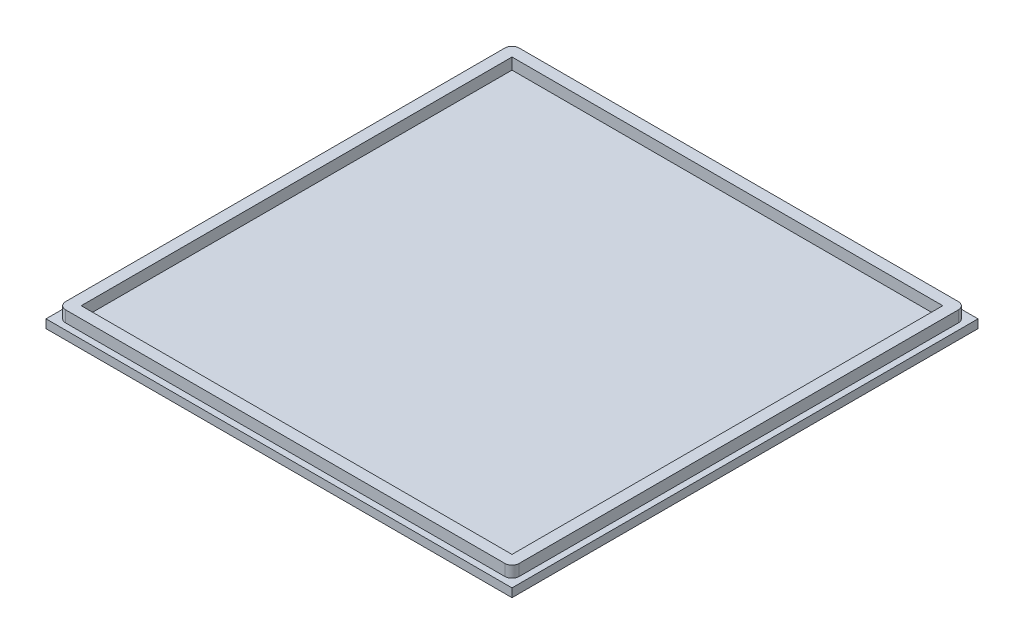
SolidWorks part; units mm, degrees
ref_plane "Front Plane" through (0, 0, 0) normal (0, 0, 1) x (1, 0, 0)
ref_plane "Top Plane" through (0, 0, 0) normal (0, 1, 0) x (1, 0, 0)
ref_plane "Right Plane" through (0, 0, 0) normal (1, 0, 0) x (0, 0, -1)
sketch "Sketch1" plane through (0, 0, 0) normal (0, 1, 0) x (1, 0, 0)
  line L2 (-82, 82) -> (82, 82)
  line L3 (-82, 82) -> (-82, -82)
  line L4 (-82, -82) -> (82, -82)
  line L5 (82, 82) -> (82, -82)
  line L6 (-82, 82) -> (82, -82) construction
  line L7 (-82, -82) -> (82, 82) construction
  point P1 (0, 0)
  dimension "D1" = 164
  dimension "D2" = 164
extrude "Boss-Extrude1" add sketch "Sketch1" along normal blind 3
sketch "Sketch2" plane through (0, 3, 0) normal (0, 1, 0) x (1, 0, 0)
  line L0 (79.8, -82) -> (82, -82) construction
  line L1 (-82, -82) -> (-79.8, -82) construction
  line L2 (-82, -82) -> (-82, -79.8) construction
  line L3 (-82, -79.8) -> (-79.8, -79.8) construction
  line L4 (-79.8, -82) -> (-79.8, -79.8) construction
  line L5 (79.8, -82) -> (79.8, -79.8) construction
  line L6 (79.8, -79.8) -> (82, -79.8) construction
  line L7 (82, -82) -> (82, -79.8) construction
  line L12 (79.8, 79.8) -> (82, 79.8) construction
  line L13 (79.8, 79.8) -> (79.8, 82) construction
  line L14 (79.8, 82) -> (82, 82) construction
  line L15 (82, 79.8) -> (82, 82) construction
  line L16 (-82, 79.8) -> (-79.8, 79.8) construction
  line L17 (-82, 79.8) -> (-82, 82) construction
  line L18 (-82, 82) -> (-79.8, 82) construction
  line L19 (-79.8, 79.8) -> (-79.8, 82) construction
  line L20 (-76.4694, -74.5035) -> (-71.4694, -74.5035) construction
  line L21 (-77.3, -79.8) -> (77.3, -79.8)
  line L22 (-79.8, -77.3) -> (-79.8, 77.3)
  line L23 (-77.3, 79.8) -> (77.3, 79.8)
  line L24 (79.8, -77.3) -> (79.8, 77.3)
  line L25 (-71.4694, -74.5035) -> (-71.4694, -79.5035) construction
  line L26 (-71.4694, -79.5035) -> (-76.4694, -74.5035) construction
  arc A0 (-79.8, -77.3) -> (-77.3, -79.8) centre (-77.3, -77.3) ccw
  arc A1 (79.8, 77.3) -> (77.3, 79.8) centre (77.3, 77.3) ccw
  arc A2 (77.3, -79.8) -> (79.8, -77.3) centre (77.3, -77.3) ccw
  arc A3 (-77.3, 79.8) -> (-79.8, 77.3) centre (-77.3, 77.3) ccw
  point P11 (-75.299, 75.4914)
  dimension "D1" = 2.2
  dimension "D2" = 2.2
  dimension "D3" = 2.2
extrude "Extrude-Thin1" add sketch "Sketch2" along normal blind 4 thin
